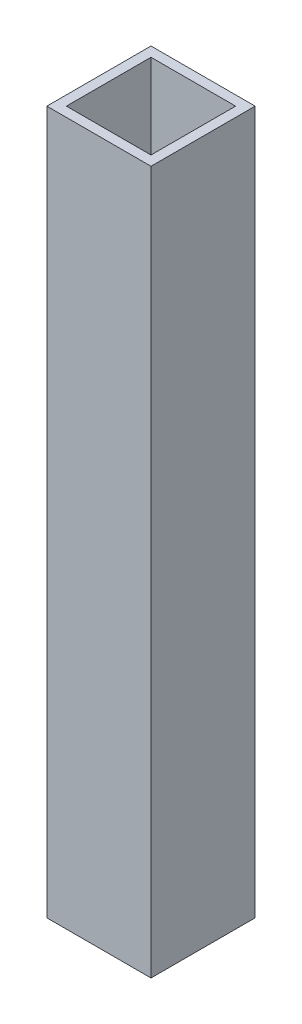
SolidWorks part; units mm, degrees
ref_plane "Front Plane" through (0, 0, 0) normal (0, 0, 1) x (1, 0, 0)
ref_plane "Top Plane" through (0, 0, 0) normal (0, 1, 0) x (1, 0, 0)
ref_plane "Right Plane" through (0, 0, 0) normal (1, 0, 0) x (0, 0, -1)
ref_plane "Plane1" through (0, 171.45, 0) normal (0, 1, 0) x (-1, 0, 0)
sketch "Sketch1" plane through (0, 171.45, 0) normal (0, 1, 0) x (-1, 0, 0)
  line L0 (-20.6375, 4.7625) -> (-20.6375, 46.0375)
  line L1 (-20.6375, 46.0375) -> (20.6375, 46.0375)
  line L2 (20.6375, 46.0375) -> (20.6375, 4.7625)
  line L3 (20.6375, 4.7625) -> (-20.6375, 4.7625)
  line L4 (-25.4, 0) -> (25.4, 0)
  line L5 (25.4, 0) -> (25.4, 50.8)
  line L6 (25.4, 50.8) -> (-25.4, 50.8)
  line L7 (-25.4, 50.8) -> (-25.4, 0)
extrude "Boss-Extrude1" add sketch "Sketch1" against normal blind 342.9
